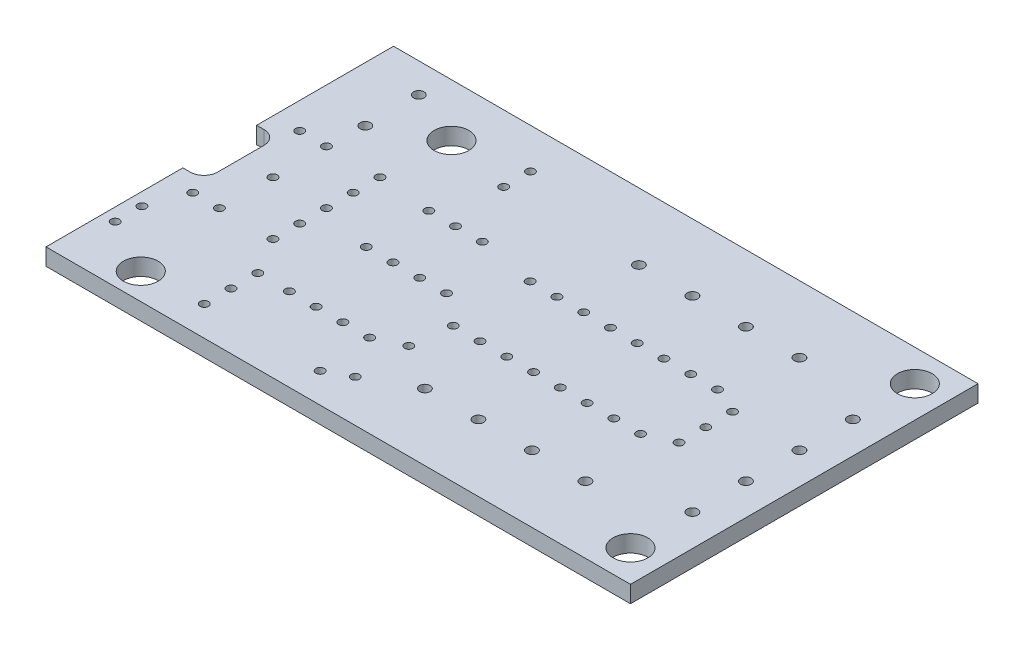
SolidWorks part; units mm, degrees
ref_plane "Plan de face" through (0, 0, 0) normal (0, 0, 1) x (1, 0, 0)
ref_plane "Plan de dessus" through (0, 0, 0) normal (0, 1, 0) x (1, 0, 0)
ref_plane "Plan de droite" through (0, 0, 0) normal (1, 0, 0) x (0, 0, -1)
sketch "Esquisse1" plane through (0, 0, 0) normal (0, 1, 0) x (1, 0, 0)
  line L0 (52.5, -4.128) -> (52.5, 36.9708) construction
  line L1 (0, 0) -> (55.5, 0)
  line L2 (0, 0) -> (0, 13)
  line L3 (0, 33) -> (55.5, 33)
  line L4 (55.5, 0) -> (55.5, 33)
  line L5 (60.8282, 13.96) -> (50.239, 13.96) construction
  line L6 (57.5256, 3) -> (47.9849, 3) construction
  line L7 (60.8282, 16.5) -> (-3.7556, 16.5) construction
  line L8 (-8.3264, 0) -> (60.8282, 0) construction
  line L9 (55.5, -4.128) -> (55.5, 36.9708) construction
  line L10 (60.8282, 8.88) -> (49.5051, 8.88) construction
  line L11 (46.15, 5.8846) -> (46.15, 22.461) construction
  line L12 (42.4281, 13.96) -> (49.5051, 13.96) construction
  line L13 (43.61, 5.8846) -> (43.61, 22.461) construction
  line L14 (41.07, 5.8846) -> (41.07, 22.461) construction
  line L15 (38.53, 5.8846) -> (38.53, 22.461) construction
  line L16 (35.99, 5.8846) -> (35.99, 22.461) construction
  line L17 (33.45, 5.8846) -> (33.45, 22.461) construction
  line L18 (30.91, 5.8846) -> (30.91, 22.461) construction
  line L19 (28.37, 5.8846) -> (28.37, 22.461) construction
  line L20 (25.83, 2.6639) -> (25.83, 22.461) construction
  line L21 (44.3895, 12.85) -> (24.8099, 12.85) construction
  line L22 (44.88, 2.6639) -> (44.88, 8.4942) construction
  line L23 (47.9849, 6.34) -> (20.7635, 6.34) construction
  line L24 (22.83, 1.1114) -> (22.83, 31.7501) construction
  line L25 (6.0036, 7.9) -> (23.4165, 7.9) construction
  line L26 (7.8504, 15.2) -> (24.4827, 15.2) construction
  line L27 (8.1062, 21.14) -> (24.4827, 21.14) construction
  line L28 (20.29, 1.1114) -> (20.29, 31.7501) construction
  line L29 (17.75, 1.1114) -> (17.75, 31.7501) construction
  line L30 (15.21, 1.1114) -> (15.21, 31.7501) construction
  line L31 (12.21, 1.1114) -> (12.21, 31.7501) construction
  line L32 (25.37, -1.3511) -> (25.37, 5.36) construction
  line L33 (28.7047, 4) -> (23.4165, 4) construction
  line L34 (25.83, 26.66) -> (6.0036, 26.66) construction
  line L35 (16.8, 24.12) -> (16.8, 43.1642) construction
  line L36 (0, -4.128) -> (0, 43.1642) construction
  line L37 (10.13, 25.0672) -> (10.13, 3.3749) construction
  line L38 (5.2, 24.12) -> (5.2, 39.2809) construction
  line L39 (-7.4769, 30.2) -> (7.8504, 30.2) construction
  line L40 (10.5, 25.0672) -> (10.5, 36.1863) construction
  line L41 (-11.5423, 28) -> (13.3355, 28) construction
  line L42 (6.5, -4.128) -> (6.5, 3.3749) construction
  line L43 (-8.3264, 2.5) -> (10.13, 2.5) construction
  line L44 (-11.5423, 33) -> (61.3921, 33) construction
  line L45 (0, 20) -> (0, 33)
  line L46 (0, 13) -> (0.7, 13)
  line L48 (0, 20) -> (0.7, 20)
  line L49 (2, 14.3) -> (2, 18.7)
  circle A0 centre (52.5, 3) radius 1.65
  circle A1 centre (52.5, 8.88) radius 0.5
  circle A2 centre (52.5, 13.96) radius 0.5
  circle A3 centre (52.5, 30) radius 1.65
  circle A4 centre (52.5, 24.12) radius 0.5
  circle A5 centre (52.5, 19.04) radius 0.5
  circle A6 centre (46.15, 13.96) radius 0.4
  circle A7 centre (46.15, 16.5) radius 0.4
  circle A8 centre (46.15, 19.04) radius 0.4
  circle A9 centre (43.61, 12.85) radius 0.4
  circle A10 centre (41.069, 12.85) radius 0.4
  circle A11 centre (38.528, 12.85) radius 0.4
  circle A12 centre (35.987, 12.85) radius 0.4
  circle A13 centre (33.446, 12.85) radius 0.4
  circle A14 centre (30.905, 12.85) radius 0.4
  circle A15 centre (28.364, 12.85) radius 0.4
  circle A16 centre (25.823, 12.85) radius 0.4
  circle A17 centre (25.823, 20.15) radius 0.4
  circle A18 centre (28.364, 20.15) radius 0.4
  circle A19 centre (30.905, 20.15) radius 0.4
  circle A20 centre (33.446, 20.15) radius 0.4
  circle A21 centre (35.987, 20.15) radius 0.4
  circle A22 centre (38.528, 20.15) radius 0.4
  circle A23 centre (41.069, 20.15) radius 0.4
  circle A24 centre (43.61, 20.15) radius 0.4
  circle A25 centre (44.88, 6.34) radius 0.5
  circle A26 centre (39.8, 6.34) radius 0.5
  circle A27 centre (34.72, 6.34) radius 0.5
  circle A28 centre (29.64, 6.34) radius 0.5
  circle A29 centre (29.64, 26.66) radius 0.5
  circle A30 centre (34.72, 26.66) radius 0.5
  circle A31 centre (39.8, 26.66) radius 0.5
  circle A32 centre (44.88, 26.66) radius 0.5
  circle A33 centre (22.83, 7.9) radius 0.4
  circle A34 centre (22.83, 15.2) radius 0.4
  circle A35 centre (12.21, 5.36) radius 0.4
  circle A36 centre (12.21, 7.9) radius 0.4
  circle A37 centre (20.29, 21.14) radius 0.4
  circle A38 centre (20.29, 15.2) radius 0.4
  circle A39 centre (20.29, 7.9) radius 0.4
  circle A40 centre (17.75, 21.14) radius 0.4
  circle A41 centre (17.75, 15.2) radius 0.4
  circle A42 centre (17.75, 7.9) radius 0.4
  circle A43 centre (15.21, 21.14) radius 0.4
  circle A44 centre (15.21, 15.2) radius 0.4
  circle A45 centre (15.21, 7.9) radius 0.4
  circle A46 centre (22.83, 21.14) radius 0.4
  circle A47 centre (12.21, 2.82) radius 0.4
  circle A48 centre (25.37, 4) radius 0.4
  circle A49 centre (25.37, 9.08) radius 0.4
  circle A50 centre (23.21, 2.82) radius 0.4
  circle A51 centre (16.8, 26.66) radius 0.4
  circle A52 centre (16.8, 29.2) radius 0.4
  circle A53 centre (1.21, 5.36) radius 0.4
  circle A54 centre (1.21, 7.9) radius 0.4
  circle A55 centre (10.13, 16.5) radius 0.4
  circle A56 centre (10.13, 13.96) radius 0.4
  circle A57 centre (10.13, 11.42) radius 0.4
  circle A58 centre (10.13, 19.04) radius 0.4
  circle A59 centre (10.13, 21.58) radius 0.4
  circle A60 centre (5.2, 30.2) radius 0.5
  circle A61 centre (5.2, 25.12) radius 0.5
  circle A62 centre (10.5, 28) radius 1.65
  circle A63 centre (5.05, 11.42) radius 0.4
  circle A64 centre (5.05, 16.5) radius 0.4
  circle A65 centre (5.05, 21.58) radius 0.4
  circle A66 centre (2.51, 11.42) radius 0.4
  circle A67 centre (6.5, 2.5) radius 1.65
  circle A68 centre (2.51, 21.58) radius 0.4
  circle A69 centre (7.59, 11.42) radius 0.4
  circle A70 centre (7.59, 16.5) radius 0.4
  circle A71 centre (7.59, 21.58) radius 0.4
  circle A72 centre (2.51, 16.5) radius 0.4
  arc A73 (0.7, 13) -> (2, 14.3) centre (0.7, 14.3) ccw
  arc A74 (0.7, 20) -> (2, 18.7) centre (0.7, 18.7) cw
  dimension "D6" = 6.35
  dimension "D8" = 3.65
  dimension "D9" = 1.27
  dimension "D11" = 3
  dimension "D15" = 4
  dimension "D17" = 16.8
  dimension "D18" = 5.08
  dimension "D19" = 11.6
  dimension "D21" = 5
  dimension "D23" = 6.5
  dimension "D25" = 3.5
  dimension "D26" = 1.3
  dimension "D1" = 16.5
  dimension "D2" = 3
  dimension "D3" = 3
  dimension "D4" = 2.54
  dimension "D5" = 5.08
  dimension "D7" = 2.54
  dimension "D12" = 7.9
  dimension "D13" = 7.3
  dimension "D16" = 2.54
  dimension "D20" = 2.8
  dimension "D22" = 10.5
  dimension "D24" = 2.5
extrude "Extrusion1" add sketch "Esquisse1" along normal blind 1.6
